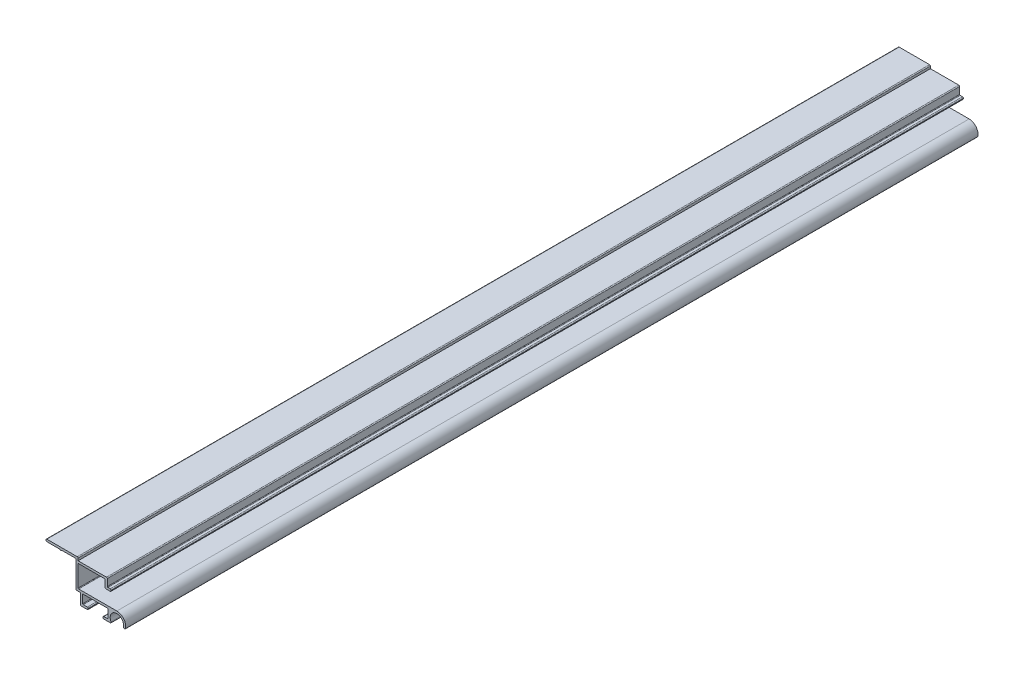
SolidWorks part; units mm, degrees
ref_plane "Plan de face" through (0, 0, 0) normal (0, 0, 1) x (1, 0, 0)
ref_plane "Plan de dessus" through (0, 0, 0) normal (0, 1, 0) x (1, 0, 0)
ref_plane "Plan de droite" through (0, 0, 0) normal (1, 0, 0) x (0, 0, -1)
sketch "Esquisse1" plane through (0, 0, 0) normal (0, 0, 1) x (1, 0, 0)
  line L0 (-7.19, 0) -> (-13.1, 0)
  line L1 (-0.25, 0) -> (-6.31, 0)
  line L2 (0, -8.04) -> (0, -11.9)
  line L3 (0.6, 1) -> (-13.1, 1)
  line L4 (-13.5, 0.4) -> (-13.5, 0.6)
  line L5 (1, -1.65) -> (1, -11.05)
  line L6 (1.25, -11.3) -> (18.5, -11.3)
  line L7 (0, -0.25) -> (0, -7.0921)
  line L8 (1, -12.3) -> (0.4, -12.3)
  line L9 (1, 0.6) -> (1, -0.4)
  line L10 (1, -0.4) -> (13.8, -0.4)
  line L11 (0, -7.0921) -> (0, -8.04)
  line L12 (1.25, -1.4) -> (12.95, -1.4)
  line L13 (1, -12.3) -> (1.8073, -12.3)
  line L14 (2.0573, -12.55) -> (2.0573, -17)
  line L15 (14.2, -0.8) -> (14.2, -3.85)
  line L16 (2.4573, -17.4) -> (5.1573, -17.4)
  line L17 (13.2, -1.65) -> (13.2, -4.7)
  line L18 (13.6, -5.1) -> (15.5, -5.1)
  line L19 (3.0573, -12.55) -> (3.0573, -16.15)
  line L20 (14.45, -4.1) -> (15.5, -4.1)
  line L21 (15.9, -4.7) -> (15.9, -4.5)
  line L22 (15.5553, -17.4) -> (12.6573, -17.4)
  line L23 (21.6729, -16.4549) -> (21.8619, -16.5236)
  line L24 (3.3073, -16.4) -> (5.1573, -16.4)
  line L25 (5.5573, -16.8) -> (5.5573, -17)
  line L26 (3.3073, -12.3) -> (14.25, -12.3)
  line L27 (12.2573, -17) -> (12.2573, -16.8)
  line L28 (14.5, -12.55) -> (14.5, -16.15)
  line L29 (12.6573, -16.4) -> (14.25, -16.4)
  arc A0 (-7.19, 0) -> (-6.31, 0) centre (-6.75, 0.33) ccw
  arc A1 (22.3875, -16.242) -> (18.5, -11.3) centre (18.5, -15.3) ccw
  arc A2 (21.4204, -15.9873) -> (15.9017, -16.8) centre (18.5, -15.3) ccw
  arc A3 (21.8619, -16.5236) -> (22.3875, -16.242) centre (21.9988, -16.1478) ccw
  arc A4 (21.6729, -16.4549) -> (21.4204, -15.9873) centre (21.8097, -16.079) cw
  arc A5 (15.9017, -16.8) -> (15.5553, -17.4) centre (15.5553, -17) cw
  arc A6 (12.2573, -16.8) -> (12.6573, -16.4) centre (12.6573, -16.8) cw
  arc A7 (12.6573, -17.4) -> (12.2573, -17) centre (12.6573, -17) cw
  arc A8 (13.6, -5.1) -> (13.2, -4.7) centre (13.6, -4.7) cw
  arc A9 (15.5, -5.1) -> (15.9, -4.7) centre (15.5, -4.7) ccw
  arc A10 (15.5, -4.1) -> (15.9, -4.5) centre (15.5, -4.5) cw
  arc A11 (14.2, -0.8) -> (13.8, -0.4) centre (13.8, -0.8) ccw
  arc A12 (5.1573, -16.4) -> (5.5573, -16.8) centre (5.1573, -16.8) cw
  arc A13 (5.1573, -17.4) -> (5.5573, -17) centre (5.1573, -17) ccw
  arc A14 (2.0573, -17) -> (2.4573, -17.4) centre (2.4573, -17) ccw
  arc A15 (0, -11.9) -> (0.4, -12.3) centre (0.4, -11.9) ccw
  arc A16 (0.6, 1) -> (1, 0.6) centre (0.6, 0.6) cw
  arc A17 (-13.1, 0) -> (-13.5, 0.4) centre (-13.1, 0.4) cw
  arc A18 (-13.1, 1) -> (-13.5, 0.6) centre (-13.1, 0.6) ccw
  arc A19 (3.0573, -16.15) -> (3.3073, -16.4) centre (3.3073, -16.15) ccw
  arc A20 (14.5, -16.15) -> (14.25, -16.4) centre (14.25, -16.15) cw
  arc A21 (14.5, -12.55) -> (14.25, -12.3) centre (14.25, -12.55) ccw
  arc A22 (2.0573, -12.55) -> (1.8073, -12.3) centre (1.8073, -12.55) ccw
  arc A23 (3.0573, -12.55) -> (3.3073, -12.3) centre (3.3073, -12.55) cw
  arc A24 (1.25, -11.3) -> (1, -11.05) centre (1.25, -11.05) cw
  arc A25 (14.45, -4.1) -> (14.2, -3.85) centre (14.45, -3.85) cw
  arc A26 (13.2, -1.65) -> (12.95, -1.4) centre (12.95, -1.65) ccw
  arc A27 (1, -1.65) -> (1.25, -1.4) centre (1.25, -1.65) cw
  arc A28 (-0.25, 0) -> (0, -0.25) centre (-0.25, -0.25) cw
  point P31 (22.2588, -16.6681)
  point P41 (21.3192, -16.3261)
  point P44 (16.3573, -17.4)
  point P49 (12.2573, -17.4)
  point P54 (15.9, -5.1)
  point P57 (15.9, -4.1)
  point P60 (14.2, -0.4)
  point P63 (5.5573, -16.4)
  point P66 (5.5573, -17.4)
  point P69 (2.0573, -17.4)
  point P74 (1, 1)
  point P77 (-13.5, 0)
  point P80 (-13.5, 1)
  point P89 (2.0573, -12.3)
  point P92 (3.0573, -12.3)
  point P95 (1, -11.3)
  point P98 (14.2, -4.1)
  point P105 (0, 0)
  dimension "D3" = 1.1
  dimension "D15" = 6.1
  dimension "D18" = 17.5
  dimension "D16" = 8
  dimension "D30" = 0.4
  dimension "D31" = 0.25
  dimension "D1" = 13.5
  dimension "D2" = 1
  dimension "D4" = 14.3
  dimension "D5" = 0.33
  dimension "D7" = 13.2
  dimension "D6" = 4.1
  dimension "D8" = 1.4
  dimension "D9" = 1
  dimension "D10" = 3.7
  dimension "D11" = 11.9
  dimension "D12" = 1
  dimension "D13" = 2.7
  dimension "D14" = 1
  dimension "D17" = 3.5
  dimension "D19" = 18.5
  dimension "D20" = 4
  dimension "D21" = 1
  dimension "D22" = 1
  dimension "D23" = 1
  dimension "D24" = 5.1
  dimension "D25" = 2.0573
  dimension "D26" = 4.1
  dimension "D27" = 160
  dimension "D28" = 6.75
  dimension "D29" = 0.9998
extrude "Boss.-Extru.1" add sketch "Esquisse1" along normal blind 385
